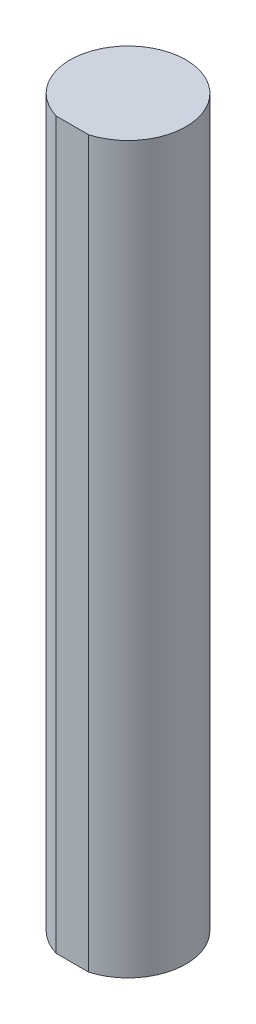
SolidWorks part; units mm, degrees
ref_plane "Front Plane" through (0, 0, 0) normal (0, 0, 1) x (1, 0, 0)
ref_plane "Top Plane" through (0, 0, 0) normal (0, 1, 0) x (1, 0, 0)
ref_plane "Right Plane" through (0, 0, 0) normal (1, 0, 0) x (0, 0, -1)
sketch "Sketch1" plane through (0, 0, 0) normal (0, 1, 0) x (1, 0, 0)
  circle A0 centre (0, 0) radius 3.175
extrude "Boss-Extrude1" add sketch "Sketch1" along normal blind 39.751
sketch "Sketch2" plane through (0, 0, 0) normal (0, -1, 0) x (1, 0, 0)
  line L1 (-2.6633, 3.6139) -> (2.5196, 3.6139)
  line L2 (-2.6633, 3.6139) -> (-2.6633, 3.048)
  line L3 (-2.6633, 3.048) -> (2.5196, 3.048)
  line L4 (2.5196, 3.6139) -> (2.5196, 3.048)
  circle A0 centre (0, 0) radius 3.175 construction
  dimension "D1" = 3.048
extrude "Cut-Extrude1" cut sketch "Sketch2" against normal through all
